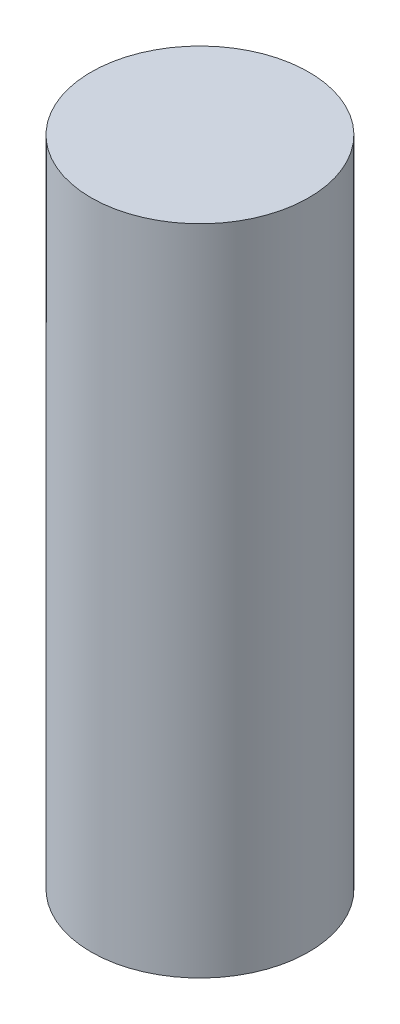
SolidWorks part; units mm, degrees
ref_plane "Alzado" through (0, 0, 0) normal (0, 0, 1) x (1, 0, 0)
ref_plane "Planta" through (0, 0, 0) normal (0, 1, 0) x (1, 0, 0)
ref_plane "Vista lateral" through (0, 0, 0) normal (1, 0, 0) x (0, 0, -1)
sketch "Croquis1" plane through (0, 0, 0) normal (0, 1, 0) x (1, 0, 0)
  circle A0 centre (0, 0) radius 2.5
  dimension "D1" = 5
extrude "Saliente-Extruir1" add sketch "Croquis1" along normal mid plane 15
